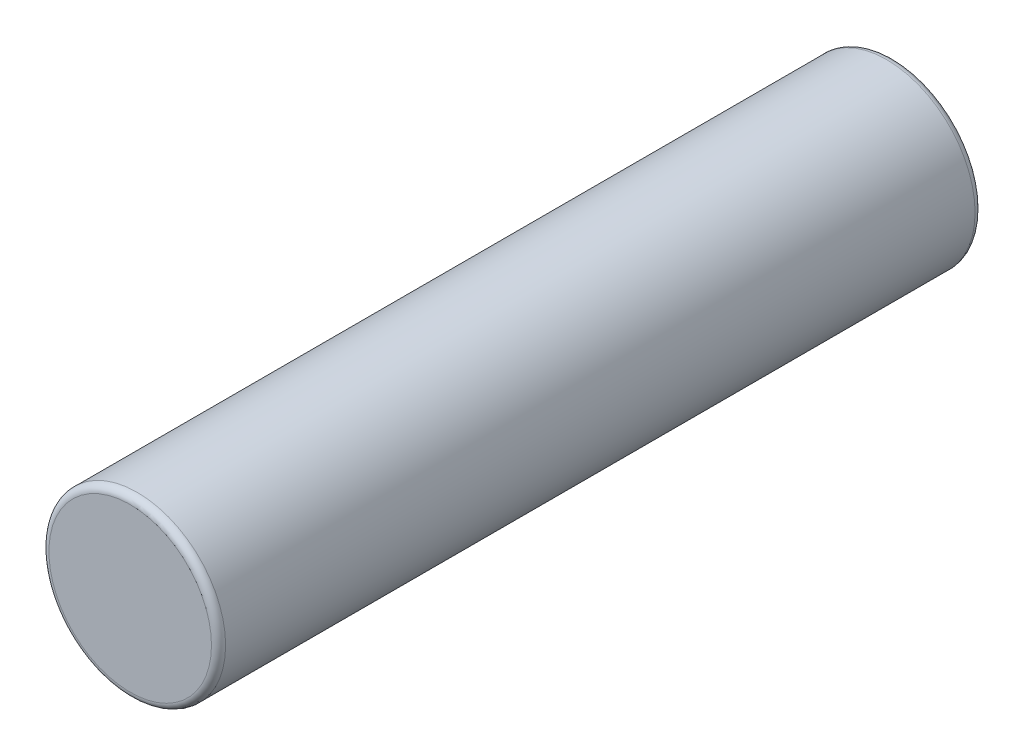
SolidWorks part; units mm, degrees
ref_plane "Front Plane" through (0, 0, 0) normal (0, 0, 1) x (1, 0, 0)
ref_plane "Top Plane" through (0, 0, 0) normal (0, 1, 0) x (1, 0, 0)
ref_plane "Right Plane" through (0, 0, 0) normal (1, 0, 0) x (0, 0, -1)
sketch "Sketch1" plane through (0, 0, 0) normal (0, 0, 1) x (1, 0, 0)
  circle A0 centre (0, 0) radius 12.495
  dimension "D1" = 24.99
extrude "Extrude1" add sketch "Sketch1" along normal blind 108
fillet "Fillet1" radius 1 2 edges at (12.495, 0, 0) (12.495, 0, 108)
